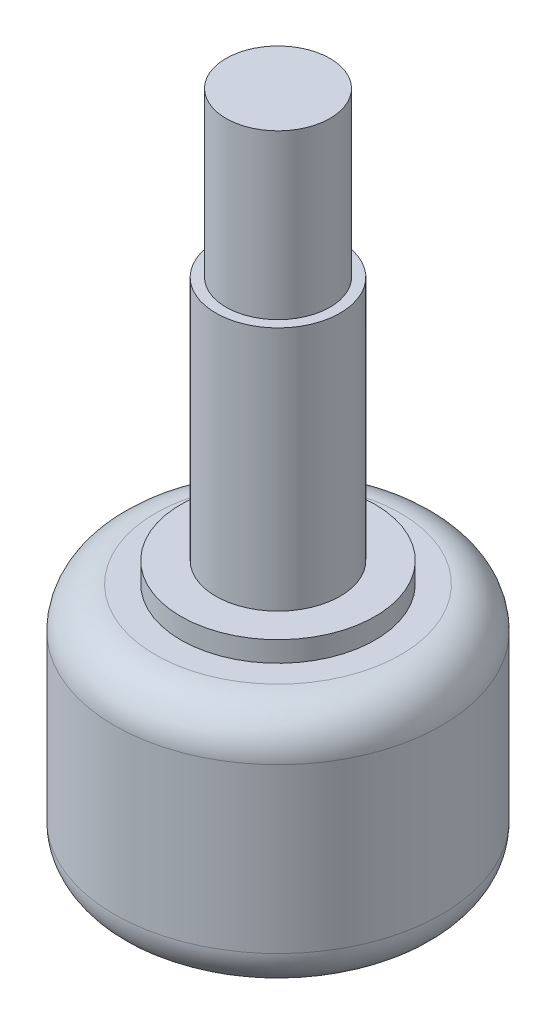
SolidWorks part; units mm, degrees
ref_plane "FRONT" through (0, 0, 0) normal (0, 0, 1) x (1, 0, 0)
ref_plane "TOP" through (0, 0, 0) normal (0, 1, 0) x (1, 0, 0)
ref_plane "RIGHT" through (0, 0, 0) normal (1, 0, 0) x (0, 0, -1)
sketch "Sketch1" plane through (0, 0, 0) normal (0, 0, 1) x (1, 0, 0)
  line L0 (0, 0) -> (0, 61.7457) construction
  line L1 (0, 0) -> (-4.7625, 0)
  line L2 (-6.35, 1.5875) -> (-6.35, 7.9375)
  line L3 (-4.7625, 9.525) -> (-3.7703, 9.525)
  line L4 (-3.7703, 9.525) -> (-3.7703, 10.3187)
  line L5 (-3.7703, 10.3187) -> (-2.413, 10.3187)
  line L6 (-2.413, 10.3187) -> (-2.413, 19.8438)
  line L7 (-2.0193, 26.1938) -> (0, 26.1938)
  line L8 (0, 26.1938) -> (0, 0)
  line L9 (-2.413, 19.8438) -> (-2.0193, 19.8438)
  line L10 (-2.0193, 19.8438) -> (-2.0193, 26.1938)
  arc A0 (-4.7625, 9.525) -> (-6.35, 7.9375) centre (-4.7625, 7.9375) ccw
  arc A1 (-6.35, 1.5875) -> (-4.7625, 0) centre (-4.7625, 1.5875) ccw
  dimension "D1" = 1.5875
  dimension "ROLLER WIDTH" = 9.525
  dimension "FOLLOWER DIA" = 12.7
  dimension "D4" = 0.7937
  dimension "STUD DIA" = 4.826
  dimension "MIN BOSS DIA" = 7.5406
  dimension "STUD LENGTH" = 15.875
  dimension "MIN PERFECT THREAD" = 6.35
  dimension "MIN THREAD DIA" = 4.0386
revolve "Base-Revolve" add sketch "Sketch1" angle 360 about L0
